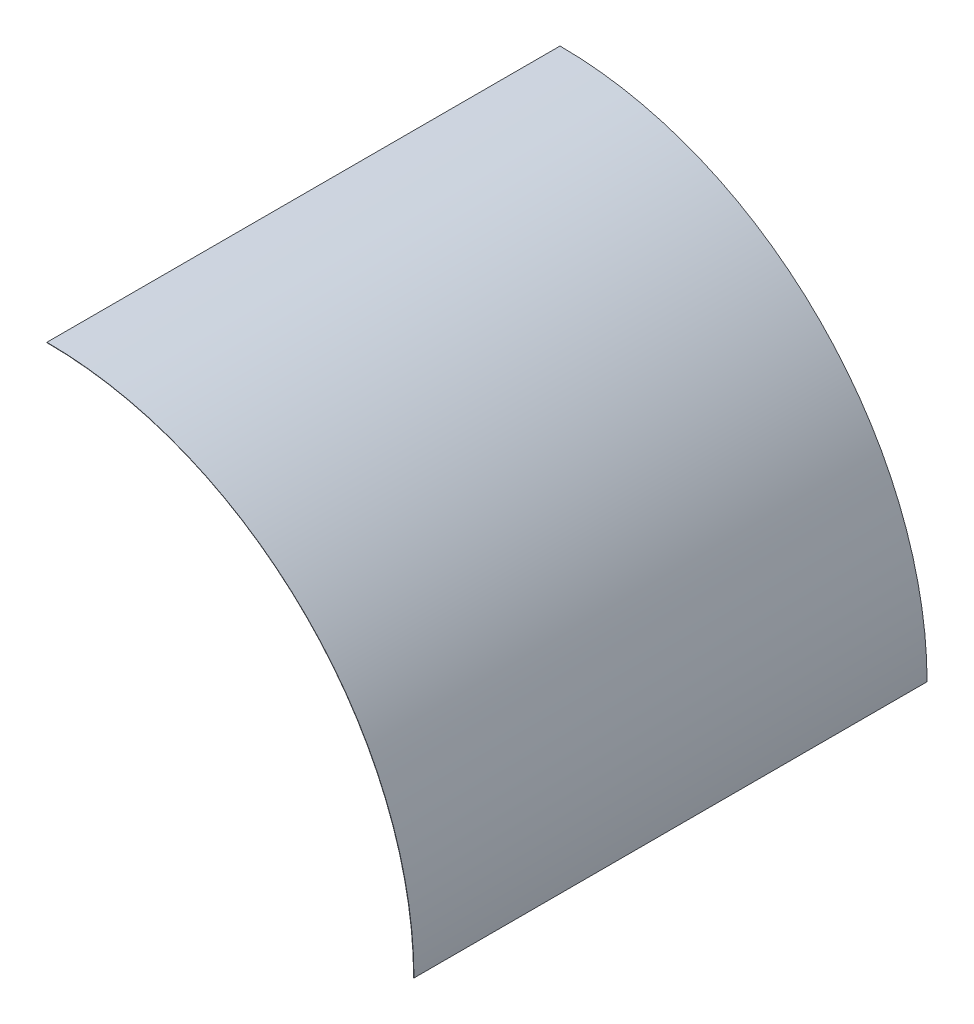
SolidWorks part; units mm, degrees
ref_plane "Front Plane" through (0, 0, 0) normal (0, 0, 1) x (1, 0, 0)
ref_plane "Top Plane" through (0, 0, 0) normal (0, 1, 0) x (1, 0, 0)
ref_plane "Right Plane" through (0, 0, 0) normal (1, 0, 0) x (0, 0, -1)
sketch "Sketch1" plane through (0, 0, 0) normal (0, 0, 1) x (1, 0, 0)
  line L0 (0, 0) -> (0, 45.174) construction
  line L1 (0, 0) -> (40.8023, 0) construction
  line L2 (0, 2146) -> (0, 2144)
  line L3 (2146, 0) -> (2144, 0)
  arc A0 (0, 2144) -> (2144, 0) centre (0, 0) cw
  arc A1 (0, 2146) -> (2146, 0) centre (0, 0) cw
  dimension "D1" = 2144
  dimension "D2" = 2
extrude "Boss-Extrude1" add sketch "Sketch1" against normal blind 3000
